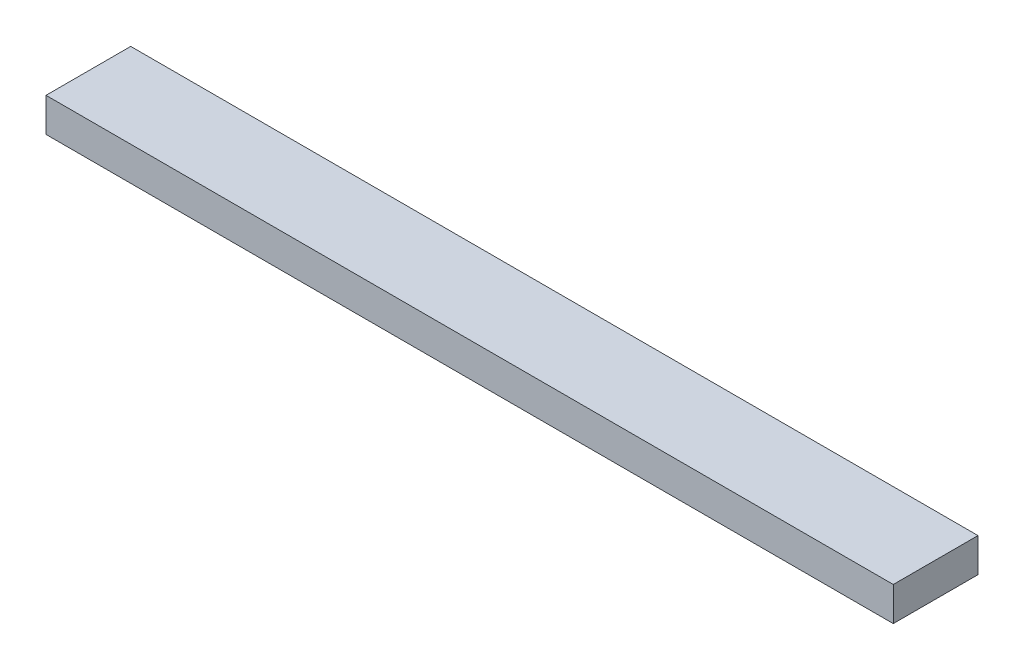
SolidWorks part; units mm, degrees
ref_plane "Ebene vorne" through (0, 0, 0) normal (0, 0, 1) x (1, 0, 0)
ref_plane "Ebene oben" through (0, 0, 0) normal (0, 1, 0) x (1, 0, 0)
ref_plane "Ebene rechts" through (0, 0, 0) normal (1, 0, 0) x (0, 0, -1)
sketch "Skizze1" plane through (0, 0, 0) normal (0, 1, 0) x (1, 0, 0)
  line L0 (-250, 0) -> (-250, -50)
  line L1 (-250, -50) -> (250, -50)
  line L2 (250, -50) -> (250, 0)
  line L4 (-250, 0) -> (250, 0)
  dimension "D1" = 500
  dimension "D2" = 50
extrude "Aufsatz-Linear austragen1" add sketch "Skizze1" against normal blind 20
